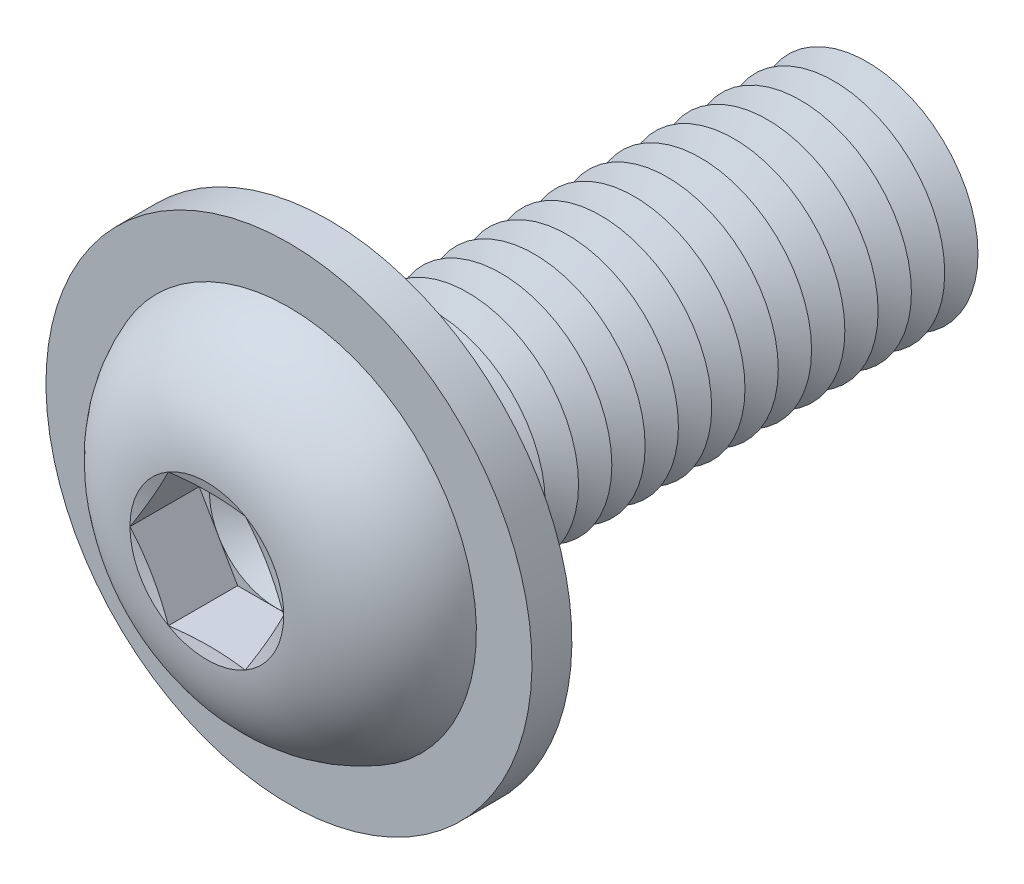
SolidWorks part; units mm, degrees
ref_plane "Front Plane" through (0, 0, 0) normal (0, 0, 1) x (1, 0, 0)
ref_plane "Top Plane" through (0, 0, 0) normal (0, 1, 0) x (1, 0, 0)
ref_plane "Right Plane" through (0, 0, 0) normal (1, 0, 0) x (0, 0, -1)
sketch "Sketch1" plane through (0, 0, 0) normal (1, 0, 0) x (0, 0, -1)
  line L0 (0, 5) -> (0, 8.75)
  line L3 (0, 5) -> (25, 5)
  line L4 (25, 5) -> (25, 0)
  line L5 (25, 0) -> (-5.5, 0) construction
  line L6 (-5.5, 0) -> (25, 0)
  line L7 (-5.5, 3.4641) -> (-5.5, 1.732) construction
  line L8 (-5.5, 1.732) -> (-5.5, 0)
  line L9 (-5.5, 3.4641) -> (-5.0359, 1.732)
  line L10 (-5.0359, 1.732) -> (-5.5, 1.732)
  line L11 (25, 0) -> (22.7481, 0) construction
  line L12 (0, 8.75) -> (-5.5, 8.75) construction
  arc A1 (0, 8.75) -> (-5.5, 3.4641) centre (0, 3.2457) ccw
  point P8 (25, 2.5)
  dimension "D1" = 17.5
  dimension "D2" = 10
  dimension "D3" = 5.5
  dimension "D4" = 6.9282
  dimension "D5" = 25
  dimension "D6" = 15
revolve "Revolve1" add sketch "Sketch1" angle 360 about L5
fillet "Fillet1" radius 0.75 1 edges at (-5, 0, 0)
sketch "Sketch2" plane through (0, 0, 0) normal (1, 0, 0) x (0, 0, -1)
  line L0 (24.25, 5) -> (25.75, 5)
  line L1 (25, 5) -> (0.75, 5) construction
  line L2 (25.75, 5) -> (25, 3.701)
  line L3 (25, -5) -> (25, 5) construction
  line L4 (25, 3.701) -> (24.25, 5)
  dimension "D1" = 1.5
revolve "Cut-Revolve1" cut sketch "Sketch2" angle 360 about axis through (0, 0, -25) along (0, 0, -1)
pattern_linear "LPattern1" count 16 spacing 1.5 along (0, 0, 1) of "Cut-Revolve1"
sketch "Sketch3" plane through (0, 0, 5.5) normal (0, 0, 1) x (1, 0, 0)
  line L7 (1.732, 3) -> (-1.7321, 3)
  line L8 (-1.7321, 3) -> (-3.4641, 0)
  line L9 (-3.4641, 0) -> (-1.732, -3)
  line L10 (-1.732, -3) -> (1.732, -3)
  line L11 (1.732, -3) -> (3.4641, 0)
  line L12 (3.4641, 0) -> (1.732, 3)
  circle A0 centre (0, 0) radius 3 construction
  circle A3 centre (0, 0) radius 3.4641 construction
extrude "Cut-Extrude1" cut sketch "Sketch3" against normal blind 3.12
sketch "Sketch4" plane through (0, 0, 2.38) normal (0, 0, 1) x (1, 0, 0)
  line L1 (1.732, 3) -> (-1.7321, 3) construction
  circle A0 centre (0, 0) radius 3
extrude "Cut-Extrude2" cut sketch "Sketch4" against normal through all draft 60
sketch "Sketch5" plane through (0, 0, 0) normal (0, 0, -1) x (-1, 0, 0)
  circle A0 centre (0, 0) radius 10.95
  circle A1 centre (0, 0) radius 5.75
  circle A2 centre (0, 0) radius 5.75 construction
  dimension "D1" = 21.9
extrude "Boss-Extrude1" add sketch "Sketch5" against normal blind 1.8
